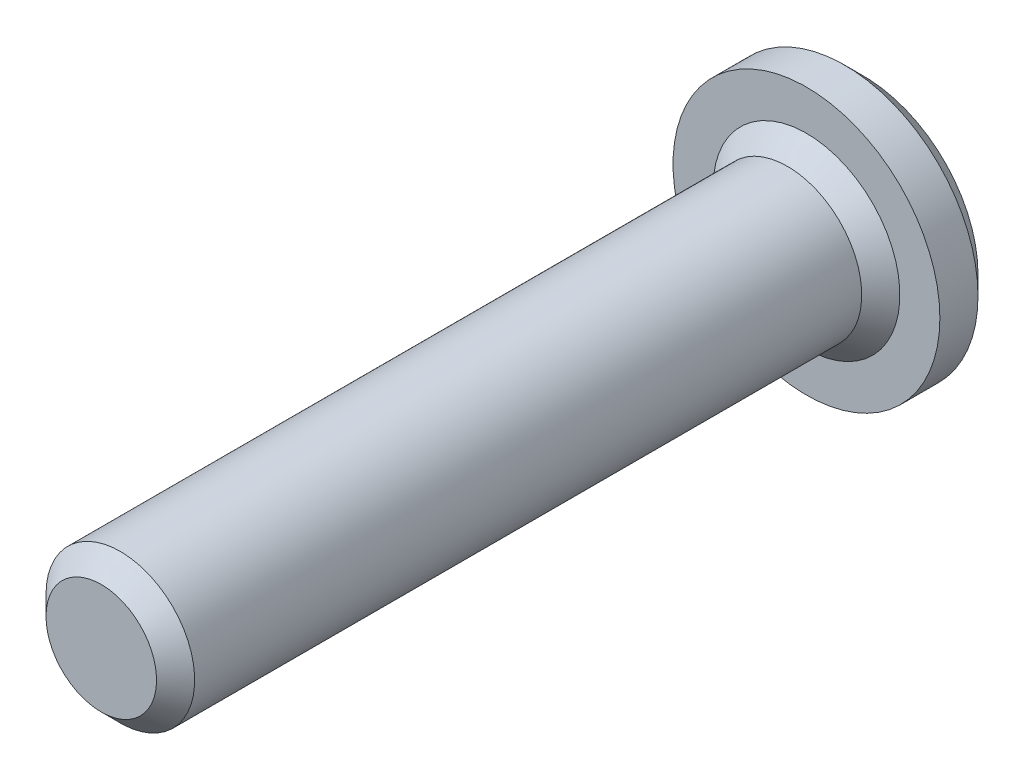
SolidWorks part; units mm, degrees
ref_plane "Płaszczyzna przednia" through (0, 0, 0) normal (0, 0, 1) x (1, 0, 0)
ref_plane "Płaszczyzna górna" through (0, 0, 0) normal (0, 1, 0) x (1, 0, 0)
ref_plane "Płaszczyzna prawa" through (0, 0, 0) normal (1, 0, 0) x (0, 0, -1)
sketch "Szkic2" plane through (0, 0, 0) normal (0, 1, 0) x (1, 0, 0)
  line L0 (-7, 0) -> (-3.9, 0)
  line L1 (-3.9, 0) -> (-3.9, -37)
  line L2 (-3.9, -37) -> (0, -37)
  line L3 (0, -37) -> (0, 3)
  line L4 (-7, 0) -> (-7, 3)
  line L5 (-7, 3) -> (0, 3)
  dimension "D4" = 7
  dimension "D1" = 3.9
  dimension "D2" = 40
  dimension "D3" = 3
revolve "Obrót1" add sketch "Szkic2" angle 360 about L3
chamfer "Sfazowanie1" distance 1 angle 45 3 edges at (7, 0, -3) (3.9, 0, 0) (3.9, 0, 37)
